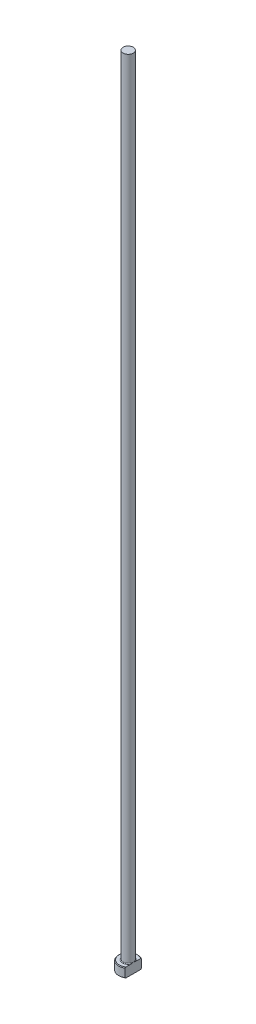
SolidWorks part; units mm, degrees
ref_plane "Front Plane" through (0, 0, 0) normal (0, 0, 1) x (1, 0, 0)
ref_plane "Top Plane" through (0, 0, 0) normal (0, 1, 0) x (1, 0, 0)
ref_plane "Right Plane" through (0, 0, 0) normal (1, 0, 0) x (0, 0, -1)
sketch "Sketch1" plane through (0, 0, 0) normal (0, 0, 1) x (1, 0, 0)
  line L0 (0, 259.9588) -> (0, -15.1925) construction
  line L1 (0, 0) -> (-3, 0)
  line L2 (-3, 0) -> (-3, 3)
  line L3 (-3, 3) -> (-1.6, 3)
  line L4 (-1.6, 3) -> (-1.6, 250)
  line L5 (-1.6, 250) -> (0, 250)
  line L6 (0, 250) -> (0, 0)
  dimension "L" = 250
  dimension "H" = 6
  dimension "T" = 3
  dimension "D" = 3.2
revolve "Revolve1" add sketch "Sketch1" angle 360 about L0
chamfer "Chamfer1" distance 0.2 angle 45 2 edges at (0, 3, 3) (0, 0, 3)
fillet "Fillet1" radius 0.2 1 edges at (0, 3, 1.6)
sketch "Sketch2" plane through (0, 0, 0) normal (0, 1, 0) x (1, 0, 0)
  line L0 (1.6, 2.5377) -> (1.6, -2.5377)
  circle A0 centre (0, 0) radius 3 construction
  arc A1 (1.6, -2.5377) -> (1.6, 2.5377) centre (0, 0) ccw
  circle A2 centre (0, 0) radius 1.6 construction
extrude "KEY" cut sketch "Sketch2" along normal through all
